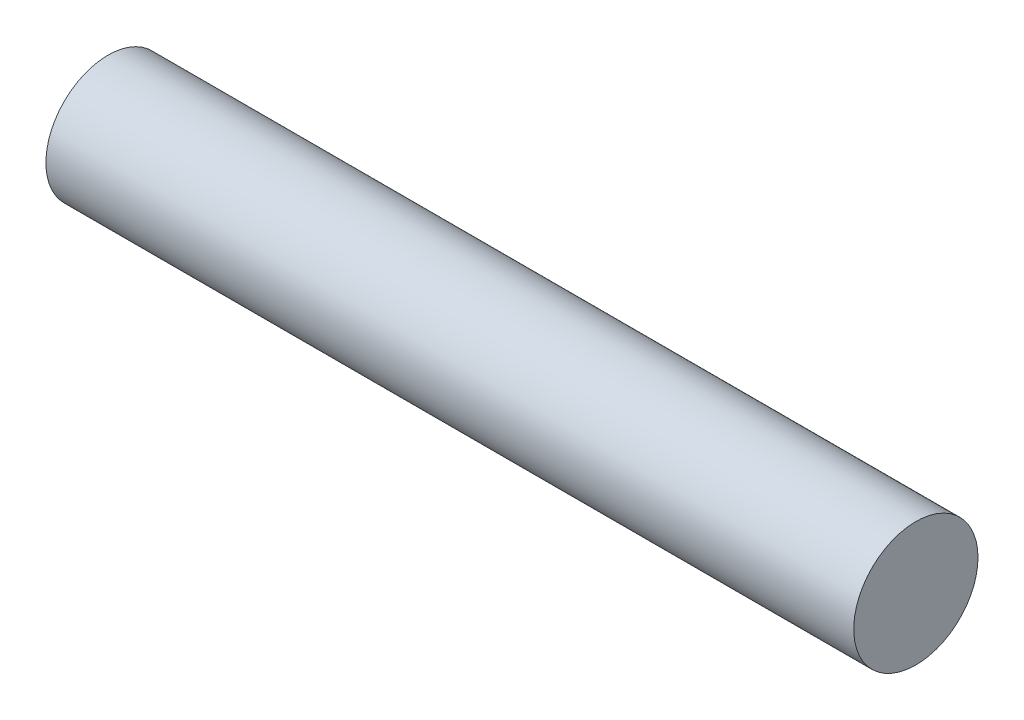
SolidWorks part; units mm, degrees
ref_plane "前视基准面" through (0, 0, 0) normal (0, 0, 1) x (1, 0, 0)
ref_plane "上视基准面" through (0, 0, 0) normal (0, 1, 0) x (1, 0, 0)
ref_plane "右视基准面" through (0, 0, 0) normal (1, 0, 0) x (0, 0, -1)
other "Configuration Table"
sketch "草图1" plane through (0, 0, 0) normal (1, 0, 0) x (0, 0, -1)
  circle A0 centre (0, 0) radius 2
extrude "01_SHAFT_D4_L26" add sketch "草图1" against normal mid plane 26
